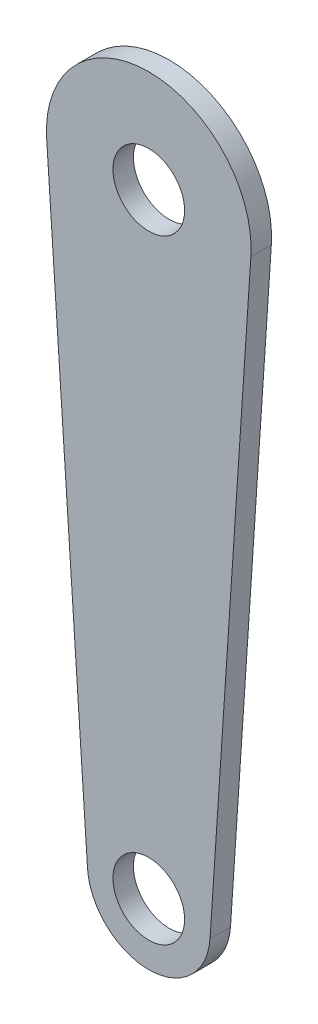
SolidWorks part; units mm, degrees
ref_plane "Front Plane" through (0, 0, 0) normal (0, 0, 1) x (1, 0, 0)
ref_plane "Top Plane" through (0, 0, 0) normal (0, 1, 0) x (1, 0, 0)
ref_plane "Right Plane" through (0, 0, 0) normal (1, 0, 0) x (0, 0, -1)
sketch "Sketch1" plane through (0, 0, 0) normal (0, 0, 1) x (1, 0, 0)
  line L0 (0, 0) -> (0, 52.1453) construction
  line L1 (-4.9889, 29.6667) -> (-2.9933, -0.2)
  line L2 (4.9889, 29.6667) -> (2.9933, -0.2)
  arc A0 (-2.9933, -0.2) -> (2.9933, -0.2) centre (0, 0) ccw
  arc A1 (4.9889, 29.6667) -> (-4.9889, 29.6667) centre (0, 30) ccw
  circle A2 centre (0, 30) radius 1.75
  circle A3 centre (0, 0) radius 1.75
  dimension "D1" = 10
  dimension "D2" = 6
  dimension "D3" = 30
  dimension "D4" = 3.5
  dimension "D5" = 3.5
extrude "Extrude1" add sketch "Sketch1" along normal blind 1
